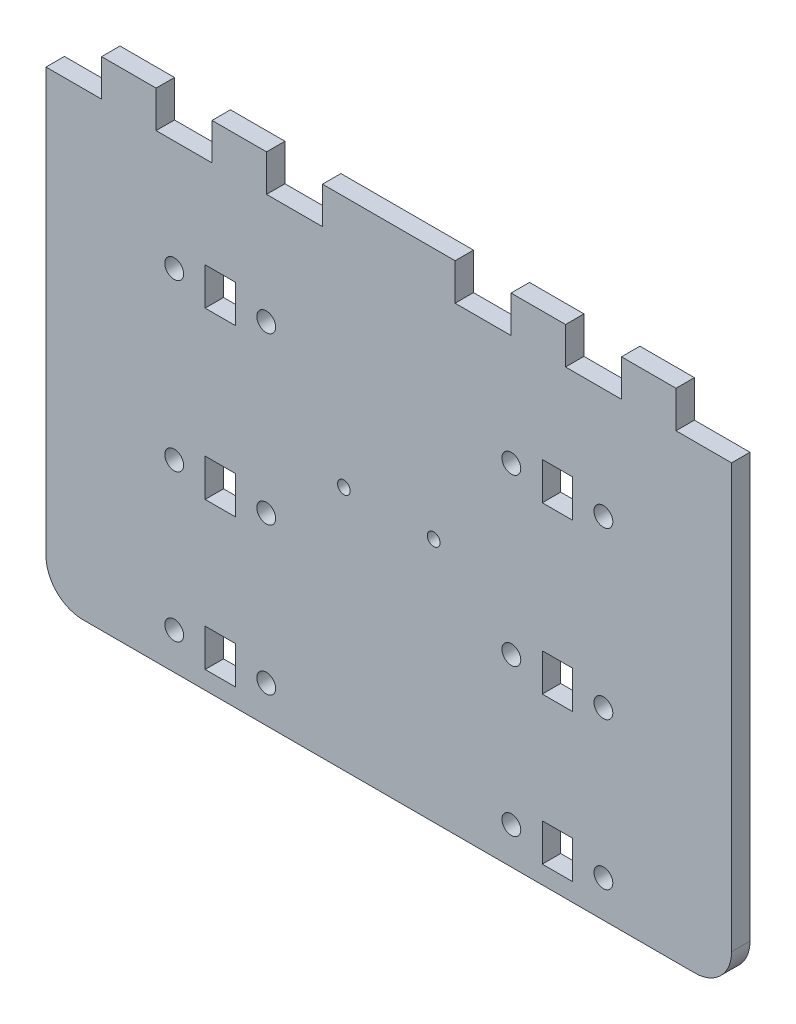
SolidWorks part; units mm, degrees
ref_plane "Front Plane" through (0, 0, 0) normal (0, 0, 1) x (1, 0, 0)
ref_plane "Top Plane" through (0, 0, 0) normal (0, 1, 0) x (1, 0, 0)
ref_plane "Right Plane" through (0, 0, 0) normal (1, 0, 0) x (0, 0, -1)
sketch "Sketch1" plane through (0, 0, 0) normal (0, 0, 1) x (1, 0, 0)
  line L0 (-118.25, 114.3) -> (-99.073, 114.3)
  line L1 (-99.073, 114.3) -> (-99.073, 127)
  line L2 (-99.073, 127) -> (-80.277, 127)
  line L3 (-80.277, 127) -> (-80.277, 114.3)
  line L4 (-80.277, 114.3) -> (-60.973, 114.3)
  line L5 (-60.973, 114.3) -> (-60.973, 127)
  line L6 (-60.973, 127) -> (-42.177, 127)
  line L7 (-42.177, 127) -> (-42.177, 114.3)
  line L8 (-42.177, 114.3) -> (-22.873, 114.3)
  line L9 (-22.873, 114.3) -> (-22.873, 127)
  line L10 (-22.873, 127) -> (22.873, 127)
  line L27 (0, 127) -> (0, 0) construction
  line L28 (22.873, 114.3) -> (22.873, 127)
  line L29 (42.177, 114.3) -> (22.873, 114.3)
  line L30 (42.177, 127) -> (42.177, 114.3)
  line L31 (60.973, 127) -> (42.177, 127)
  line L32 (60.973, 114.3) -> (60.973, 127)
  line L33 (80.277, 114.3) -> (60.973, 114.3)
  line L34 (80.277, 127) -> (80.277, 114.3)
  line L35 (99.073, 127) -> (80.277, 127)
  line L36 (99.073, 114.3) -> (99.073, 127)
  line L37 (118.25, 114.3) -> (99.073, 114.3)
  line L38 (-118.25, 114.3) -> (-118.25, 0)
  line L39 (-118.25, 0) -> (118.25, 0)
  line L40 (118.25, 114.3) -> (118.25, 0)
  point P40 (0, 127)
  point P57 (0, 0)
  dimension "D2" = 236.5
  dimension "D3" = 18.796
  dimension "D4" = 19.177
  dimension "D5" = 12.7
  dimension "D6" = 22.873
  dimension "D7" = 42.177
  dimension "D8" = 114.3
  dimension "D12" = 127
extrude "Boss-Extrude1" add sketch "Sketch1" against normal blind 6.35
sketch "Sketch2" plane through (0, 0, -6.35) normal (0, 0, -1) x (-1, 0, 0)
  line L0 (0, 0) -> (0, 127) construction
  line L1 (-22.873, 127) -> (22.873, 127) construction
ref_plane "Plane1" through (0, 0, 0) normal (-1, 0, 0) x (0, 1, 0)
sketch "Sketch3" plane through (0, 0, 0) normal (0, 0, 1) x (1, 0, 0)
  line L0 (118.25, 0) -> (118.25, 114.3) construction
  line L1 (-118.25, 0) -> (118.25, 0)
  line L2 (-118.25, 0) -> (-118.25, -44.45)
  line L3 (-118.25, -44.45) -> (118.25, -44.45)
  line L4 (118.25, 0) -> (118.25, -44.45)
  dimension "D1" = 44.45
extrude "Boss-Extrude2" add sketch "Sketch3" against normal blind 6.35
fillet "Fillet2" radius 12.7 2 edges at (118.25, -44.45, -3.175) (-118.25, -44.45, -3.175)
sketch "Sketch4" plane through (0, 0, 0) normal (0, 0, 1) x (1, 0, 0)
  line L0 (0, -44.45) -> (0, 0) construction
  line L1 (-105.55, -44.45) -> (105.55, -44.45) construction
ref_plane "Plane2" through (0, 0, 0) normal (1, 0, 0) x (0, 1, 0)
sketch "Sketch5" plane through (0, 0, 0) normal (0, 0, 1) x (1, 0, 0)
  line L0 (105.776, 76.2) -> (-105.776, 76.2) construction
  line L1 (105.776, 82.55) -> (105.776, 69.85) construction
  line L2 (-105.776, 69.85) -> (-105.776, 82.55) construction
  line L3 (-105.776, 19.05) -> (105.776, 19.05) construction
  line L4 (-105.776, 12.7) -> (-105.776, 25.4) construction
  line L5 (105.776, 25.4) -> (105.776, 12.7) construction
  line L6 (0, 76.2) -> (0, 19.05) construction
  line L7 (58.151, 82.677) -> (58.151, 69.723) construction
  line L8 (52.944, 25.527) -> (63.358, 25.527)
  line L9 (52.944, 25.527) -> (52.944, 12.573)
  line L10 (52.944, 12.573) -> (63.358, 12.573)
  line L11 (63.358, 25.527) -> (63.358, 12.573)
  line L12 (42.276, 76.2) -> (74.026, 76.2) construction
  line L13 (58.151, 76.2) -> (58.151, 73.2479) construction
  line L15 (0, 47.625) -> (100.3195, 47.625) construction
  line L16 (-63.358, 25.527) -> (-63.358, 12.573)
  line L17 (-52.944, 12.573) -> (-63.358, 12.573)
  line L18 (-52.944, 25.527) -> (-52.944, 12.573)
  line L19 (-52.944, 25.527) -> (-63.358, 25.527)
  line L20 (-52.944, 69.723) -> (-63.358, 69.723)
  line L21 (-52.944, 69.723) -> (-52.944, 82.677)
  line L22 (-52.944, 82.677) -> (-63.358, 82.677)
  line L23 (-63.358, 69.723) -> (-63.358, 82.677)
  line L24 (63.358, 69.723) -> (63.358, 82.677)
  line L25 (52.944, 82.677) -> (63.358, 82.677)
  line L26 (52.944, 69.723) -> (52.944, 82.677)
  line L27 (52.944, 69.723) -> (63.358, 69.723)
  line L28 (-63.231, -31.75) -> (-53.071, -31.75) construction
  line L29 (-63.231, -25.4) -> (-63.231, -38.1) construction
  line L30 (-53.071, -25.4) -> (-53.071, -38.1) construction
  line L31 (-53.071, -31.75) -> (53.071, -31.75) construction
  line L32 (53.071, -25.4) -> (53.071, -38.1) construction
  line L33 (-23.8515, 19.05) -> (-23.8515, -31.75) construction
  line L34 (-23.8515, -6.35) -> (-79.5627, -6.35) construction
  line L35 (63.358, -38.227) -> (63.358, -25.273)
  line L36 (52.944, -25.273) -> (63.358, -25.273)
  line L37 (52.944, -38.227) -> (52.944, -25.273)
  line L38 (52.944, -38.227) -> (63.358, -38.227)
  line L39 (-52.944, -38.227) -> (-63.358, -38.227)
  line L40 (-52.944, -38.227) -> (-52.944, -25.273)
  line L41 (-52.944, -25.273) -> (-63.358, -25.273)
  line L42 (-63.358, -38.227) -> (-63.358, -25.273)
  circle A0 centre (74.026, 76.2) radius 3.25
  circle A1 centre (42.276, 76.2) radius 3.25
  circle A2 centre (74.026, 19.05) radius 3.25
  circle A3 centre (42.276, 19.05) radius 3.25
  circle A4 centre (-42.276, 19.05) radius 3.25
  circle A5 centre (-74.026, 19.05) radius 3.25
  circle A6 centre (-42.276, 76.2) radius 3.25
  circle A7 centre (-74.026, 76.2) radius 3.25
  circle A8 centre (-74.026, 76.2) radius 3.25
  circle A9 centre (-42.276, 76.2) radius 3.25
  circle A10 centre (42.276, 76.2) radius 3.25
  circle A11 centre (74.026, 76.2) radius 3.25
  circle A12 centre (42.276, -31.75) radius 3.25
  circle A13 centre (74.026, -31.75) radius 3.25
  circle A14 centre (-74.026, -31.75) radius 3.25
  circle A15 centre (-42.276, -31.75) radius 3.25
  dimension "D3" = 6.5
  dimension "D1" = 31.75
  dimension "D2" = 31.75
  dimension "D4" = 10.414
  dimension "D5" = 12.954
  dimension "D6" = 15.875
  dimension "D7" = 6.477
extrude "Cut-Extrude1" cut sketch "Sketch5" against normal through all contours L18 L19 L16 L17 | L23 L20 L21 L22 | L26 L27 L24 L25 | L11 L8 L9 L10 | A3 | A2 | A1 | A0 | A6 | A4 | A7 | A5 | L42 L39 L40 L41 | A14 | A15 | L37 L38 L35 L36 | A13 | A12
sketch "Sketch6" plane through (0, 0, 0) normal (0, 0, 1) x (1, 0, 0)
  line L0 (-15.494, 65.532) -> (-15.494, 27.432) construction
  line L1 (-12.319, 65.532) -> (-18.669, 65.532) construction
  line L2 (-12.319, 27.432) -> (-18.669, 27.432) construction
  line L3 (15.494, 27.432) -> (15.494, 65.532) construction
  line L4 (18.669, 27.432) -> (12.319, 27.432) construction
  line L5 (18.669, 65.532) -> (12.319, 65.532) construction
  circle A0 centre (-15.494, 40.132) radius 2.2
  circle A1 centre (15.494, 40.132) radius 2.2
  dimension "D1" = 4.4
  dimension "D2" = 12.7
extrude "Cut-Extrude2" cut sketch "Sketch6" against normal through all
equation "\"A\"=0.01"
equation "\"Z\"=0.01"
